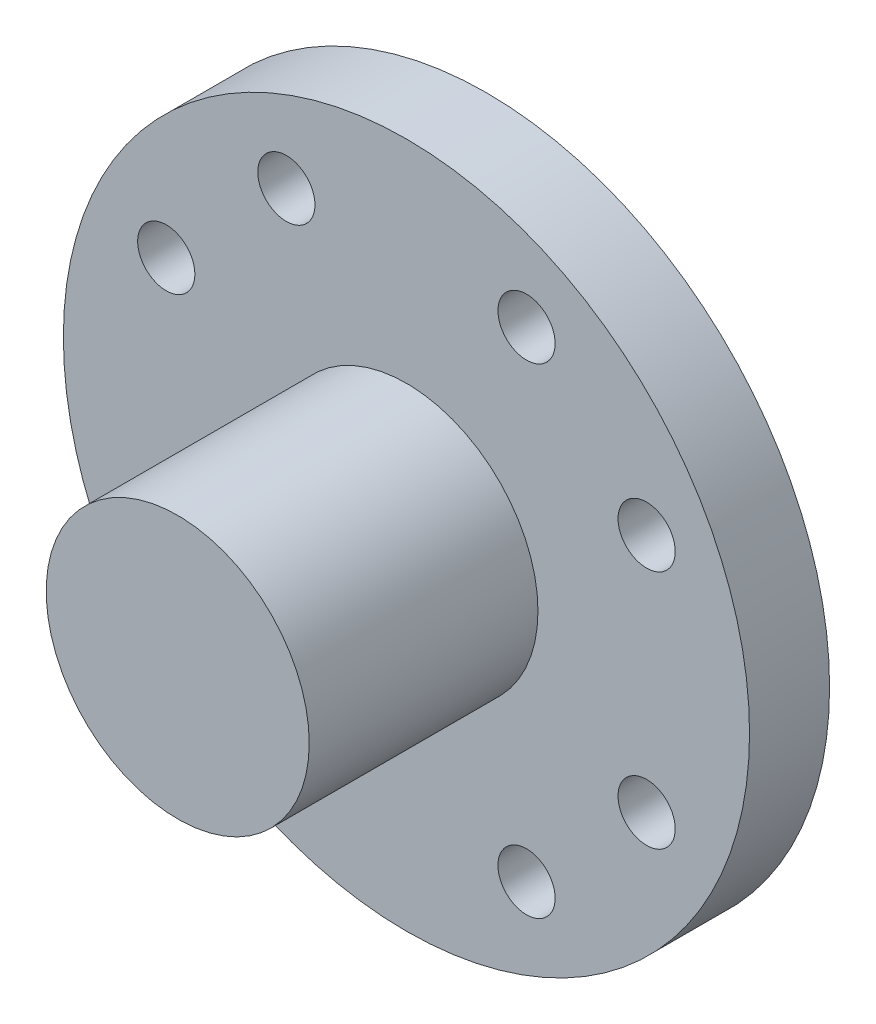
SolidWorks part; units mm, degrees
ref_plane "Front" through (0, 0, 0) normal (0, 0, 1) x (1, 0, 0)
ref_plane "Top" through (0, 0, 0) normal (0, 1, 0) x (1, 0, 0)
ref_plane "Right" through (0, 0, 0) normal (1, 0, 0) x (0, 0, -1)
sketch "Base Sketch" plane through (0, 0, 0) normal (0, 0, 1) x (1, 0, 0)
  circle A0 centre (0, 0) radius 38.1
  dimension "D1" = 76.2
extrude "Boss-Extrude Base" add sketch "Base Sketch" along normal blind 8.89
sketch "Sproket Attachment Sketch" plane through (0, 0, 8.89) normal (0, 0, 1) x (1, 0, 0)
  circle A0 centre (0, 0) radius 14.605
  dimension "D1" = 29.21
extrude "Boss-Extrude Attachment" add sketch "Sproket Attachment Sketch" along normal blind 25.4 contours A0
sketch "Holes Sketch" plane through (0, 0, 8.89) normal (0, 0, 1) x (1, 0, 0)
  line L0 (-13.335, 41.64) -> (-13.335, -41.4438) construction
  line L1 (13.335, -37.7709) -> (13.335, 72.7847) construction
  line L2 (0, -41.4438) -> (0, 72.7847) construction
  circle A0 centre (-13.335, 26.67) radius 3.175
  circle A1 centre (13.335, 26.67) radius 3.175
  circle A2 centre (26.67, 13.335) radius 3.175
  circle A3 centre (26.67, -13.335) radius 3.175
  circle A4 centre (13.335, -26.67) radius 3.175
  circle A5 centre (-13.335, -26.67) radius 3.175
  circle A6 centre (-26.67, -13.335) radius 3.175
  circle A7 centre (-26.67, 13.335) radius 3.175
  point P26 (0, 0)
  dimension "D1" = 6.35
  dimension "D2" = 6.35
  dimension "D8" = 26.67
  dimension "D3" = 26.67
  dimension "D4" = 26.67
  dimension "D5" = 13.335
  dimension "D6" = 13.335
  dimension "D9" = 13.335
  dimension "D7" = 4
extrude "Cut-Extrude Holes" cut sketch "Holes Sketch" against normal through all
